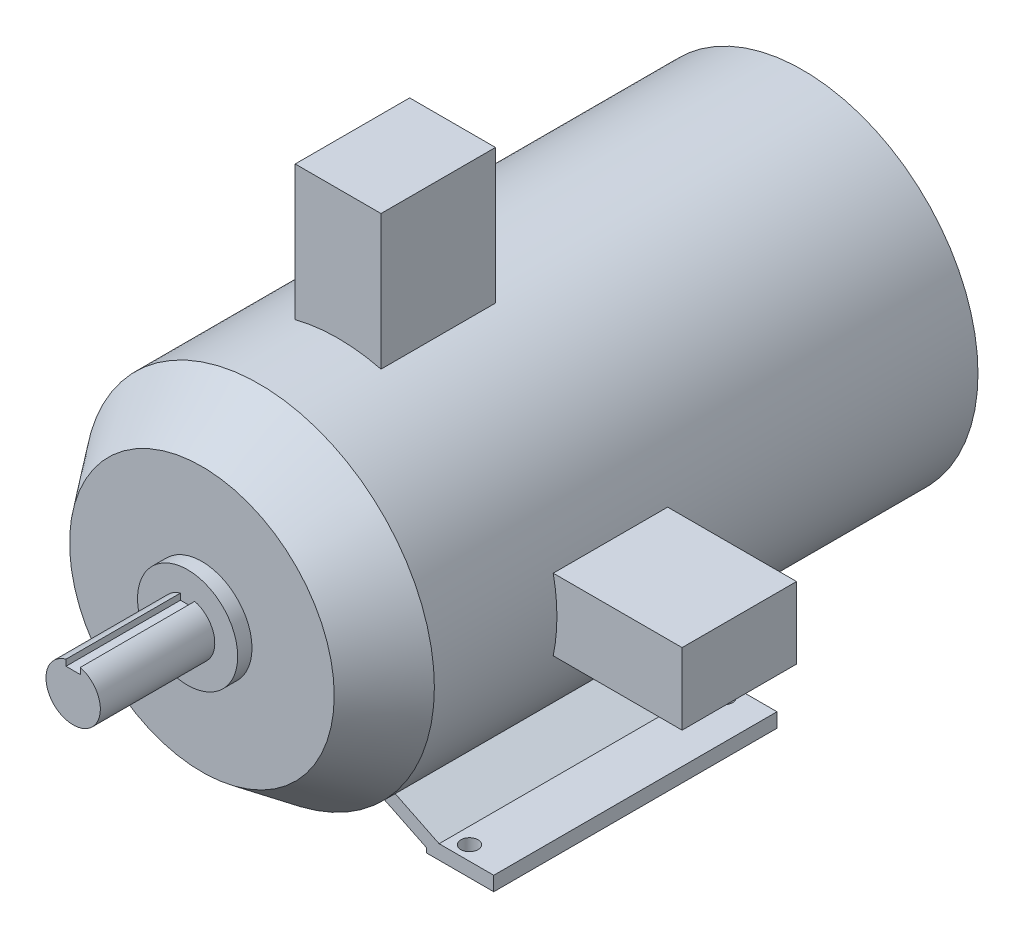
SolidWorks part; units mm, degrees
ref_plane "前视基准面" through (0, 0, 0) normal (0, 0, 1) x (1, 0, 0)
ref_plane "上视基准面" through (0, 0, 0) normal (0, 1, 0) x (1, 0, 0)
ref_plane "右视基准面" through (0, 0, 0) normal (1, 0, 0) x (0, 0, -1)
sketch "草图1" plane through (0, 0, 0) normal (0, 0, 1) x (1, 0, 0)
  circle A0 centre (0, 0) radius 122.5
  dimension "D1" = 245
extrude "拉伸1" add sketch "草图1" along normal blind 420
sketch "草图2" plane through (0, 0, 420) normal (0, 0, 1) x (1, 0, 0)
  circle A0 centre (0, 0) radius 35
  dimension "D1" = 70
extrude "拉伸2" add sketch "草图2" along normal blind 10
sketch "草图3" plane through (0, 0, 430) normal (0, 0, 1) x (1, 0, 0)
  circle A0 centre (0, 0) radius 19
  dimension "D1" = 38
extrude "拉伸3" add sketch "草图3" along normal blind 80
sketch "草图4" plane through (0, 0, 0) normal (0, 1, 0) x (1, 0, 0)
  line L0 (-122.5, -420) -> (-122.5, -380)
  line L1 (-122.5, -380) -> (-92.5, -420)
  line L2 (-122.5, -420) -> (122.5, -420) construction
  line L3 (-92.5, -420) -> (-122.5, -420)
  dimension "D1" = 30
  dimension "D2" = 40
revolve "切除-旋转1" cut sketch "草图4" angle 360 about axis through (0, 0, 420) along (0, 0, -1)
sketch "草图5" plane through (0, 0, 510) normal (0, 0, 1) x (1, 0, 0)
  line L0 (0, 163.764) -> (0, -54.382) construction
  line L1 (-5, 18.3303) -> (-5, 14)
  line L2 (-5, 14) -> (5, 14)
  line L3 (5, 14) -> (5, 18.3303)
  circle A0 centre (0, 0) radius 19 construction
  arc A1 (5, 18.3303) -> (-5, 18.3303) centre (0, 0) ccw
  dimension "D1" = 10
  dimension "D2" = 5
  dimension "D3" = 14
extrude "切除-拉伸1" cut sketch "草图5" against normal up to surface (80 mm away)
ref_plane "基准面1" through (0, 0, 351) normal (0, 0, 1) x (1, 0, 0)
sketch "草图6" plane through (0, 0, 351) normal (0, 0, 1) x (1, 0, 0)
  line L0 (0, 0) -> (0, -242.0494) construction
  line L1 (-180.6342, -132) -> (197.4911, -132) construction
  line L2 (-108, -94.707) -> (-108, -268.462) construction
  line L3 (108, -94.707) -> (108, -274.5679) construction
  line L4 (-135, -132) -> (-135, -122)
  line L5 (-135, -122) -> (-96.8003, -122)
  line L6 (-88, -128.8359) -> (-88, -132)
  line L7 (-88, -132) -> (-135, -132)
  line L8 (88, -132) -> (88, -128.8359)
  line L9 (96.8003, -122) -> (135, -122)
  line L10 (135, -122) -> (135, -132)
  line L11 (135, -132) -> (88, -132)
  line L12 (-119.7399, -110) -> (124.462, -110) construction
  line L13 (-53.9096, -110) -> (-86.1843, -125.7264) construction
  line L14 (-62.5647, -105.3181) -> (-96.8003, -122)
  line L15 (-88, -128.8359) -> (-51.6029, -111.1008)
  line L16 (86.1843, -125.7264) -> (53.9096, -110) construction
  line L17 (51.6029, -111.1008) -> (88, -128.8359)
  line L18 (96.8003, -122) -> (62.5647, -105.3181)
  circle A0 centre (0, 0) radius 122.5 construction
  arc A1 (51.6029, -111.1008) -> (62.5647, -105.3181) centre (0, 0) ccw
  arc A2 (-62.5647, -105.3181) -> (-51.6029, -111.1008) centre (0, 0) ccw
  dimension "D1" = 108
  dimension "D2" = 216
  dimension "D3" = 132
  dimension "D4" = 270
  dimension "D5" = 20
  dimension "D6" = 20
  dimension "D7" = 10
  dimension "D8" = 10
  dimension "D9" = 110
  dimension "D10" = 10
  dimension "D11" = 8
  dimension "D12" = 10
  dimension "D13" = 8
extrude "拉伸4" add sketch "草图6" against normal blind 198
sketch "草图7" plane through (0, -132, 0) normal (0, -1, 0) x (1, 0, 0)
  line L0 (0, 574.1841) -> (0, 0) construction
  line L1 (108, 456.7194) -> (108, 114.7804) construction
  line L2 (-108, 487.4694) -> (-108, 88.9505) construction
  line L3 (88, 351) -> (135, 351) construction
  line L4 (88, 153) -> (135, 153) construction
  line L5 (-135, 351) -> (-88, 351) construction
  line L6 (-135, 153) -> (-88, 153) construction
  circle A0 centre (108, 341) radius 6
  circle A1 centre (108, 163) radius 6
  circle A2 centre (-108, 341) radius 6
  circle A3 centre (-108, 163) radius 6
  dimension "D3" = 10
  dimension "D4" = 12
  dimension "D5" = 10
  dimension "D6" = 12
  dimension "D7" = 10
  dimension "D8" = 12
  dimension "D9" = 10
  dimension "D10" = 12
  dimension "D1" = 216
  dimension "D2" = 108
extrude "切除-拉伸2" cut sketch "草图7" against normal blind 10
sketch "草图8" plane through (0, 0, 0) normal (1, 0, 0) x (0, 0, -1)
  line L0 (-568.5015, 0) -> (0, 0) construction
  line L2 (-294.3474, 25) -> (-214.3474, 25)
  line L3 (-294.3474, 25) -> (-294.3474, -25)
  line L4 (-294.3474, -25) -> (-214.3474, -25)
  line L5 (-214.3474, 25) -> (-214.3474, -25)
  dimension "D1" = 80
  dimension "D2" = 50
  dimension "D3" = 25
extrude "拉伸5" add sketch "草图8" along normal blind 210
sketch "草图9" plane through (0, 0, 0) normal (0, 1, 0) x (1, 0, 0)
  line L0 (0, 0) -> (0, -326.6292) construction
  line L1 (-30, -244.794) -> (30, -244.794)
  line L2 (-30, -244.794) -> (-30, -324.794)
  line L3 (-30, -324.794) -> (30, -324.794)
  line L4 (30, -244.794) -> (30, -324.794)
  dimension "D1" = 80
  dimension "D2" = 60
  dimension "D3" = 30
extrude "拉伸6" add sketch "草图9" along normal blind 213
